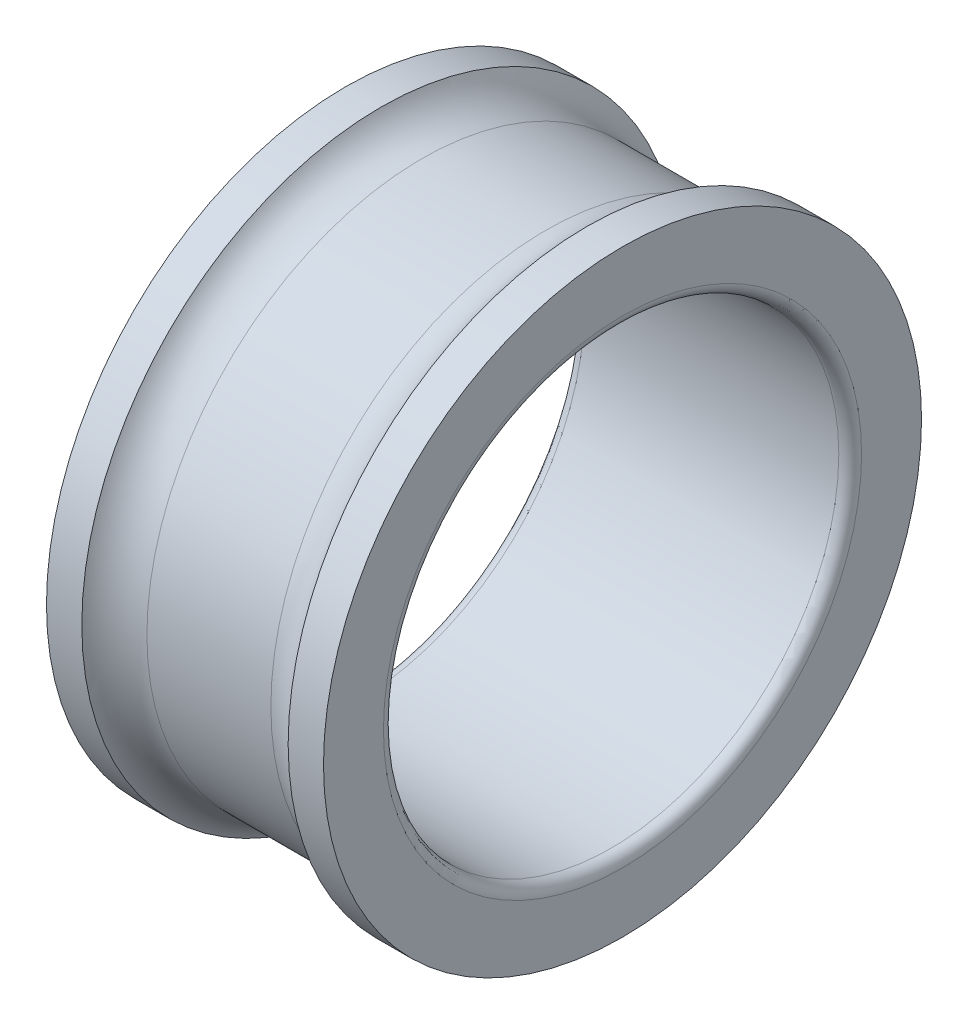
SolidWorks part; units mm, degrees
ref_plane "Plan de face" through (0, 0, 0) normal (0, 0, 1) x (1, 0, 0)
ref_plane "Plan de dessus" through (0, 0, 0) normal (0, 1, 0) x (1, 0, 0)
ref_plane "Plan de droite" through (0, 0, 0) normal (1, 0, 0) x (0, 0, -1)
sketch "Esquisse1" plane through (0, 0, 0) normal (0, 0, 1) x (1, 0, 0)
  line L0 (0, 55) -> (0, 30) construction
  line L1 (-16.75, 55) -> (16.75, 55) construction
  line L2 (-18.25, 53.5) -> (-18.25, 31.5) construction
  line L3 (-16.75, 30) -> (16.75, 30)
  line L4 (18.25, 53.5) -> (18.25, 31.5) construction
  line L5 (18.25, 45.65) -> (-18.25, 45.65) construction
  line L6 (18.25, 39.4) -> (13.5937, 39.4)
  line L7 (-18.25, 42.5) -> (18.25, 42.5) construction
  line L8 (-8.1667, 30) -> (-8.1667, 55) construction
  line L9 (0, 0) -> (18.25, 0) construction
  line L10 (13.5937, 39.4) -> (-13.5937, 39.4) construction
  line L11 (-13.5937, 39.4) -> (-18.25, 39.4)
  line L12 (18.25, 39.4) -> (18.25, 31.5)
  line L13 (-18.25, 39.4) -> (-18.25, 31.5)
  line L14 (8.1667, 36.25) -> (-8.1667, 36.25)
  arc A1 (-18.25, 31.5) -> (-16.75, 30) centre (-16.75, 31.5) ccw
  arc A2 (-16.75, 55) -> (-18.25, 53.5) centre (-16.75, 53.5) ccw construction
  arc A3 (18.25, 53.5) -> (16.75, 55) centre (16.75, 53.5) ccw construction
  arc A4 (16.75, 30) -> (18.25, 31.5) centre (16.75, 31.5) ccw
  arc A6 (-13.5937, 39.4) -> (-8.1667, 36.25) centre (-8.1667, 42.5) ccw
  arc A7 (13.5937, 39.4) -> (8.1667, 36.25) centre (8.1667, 42.5) cw
  dimension "D4" = 1.5
  dimension "D5" = 10.0833
  dimension "D8" = 12.5
  dimension "D1" = 30
  dimension "D2" = 55
  dimension "D3" = 36.5
  dimension "D6" = 39.4
  dimension "D7" = 45.65
revolve "Révolution1" add sketch "Esquisse1" angle 360 about L9
equation "\"D5@Esquisse1\"=(\"D3@Esquisse1\"-2*\"D8@Esquisse1\")/3+\"D8@Esquisse1\"/2"
